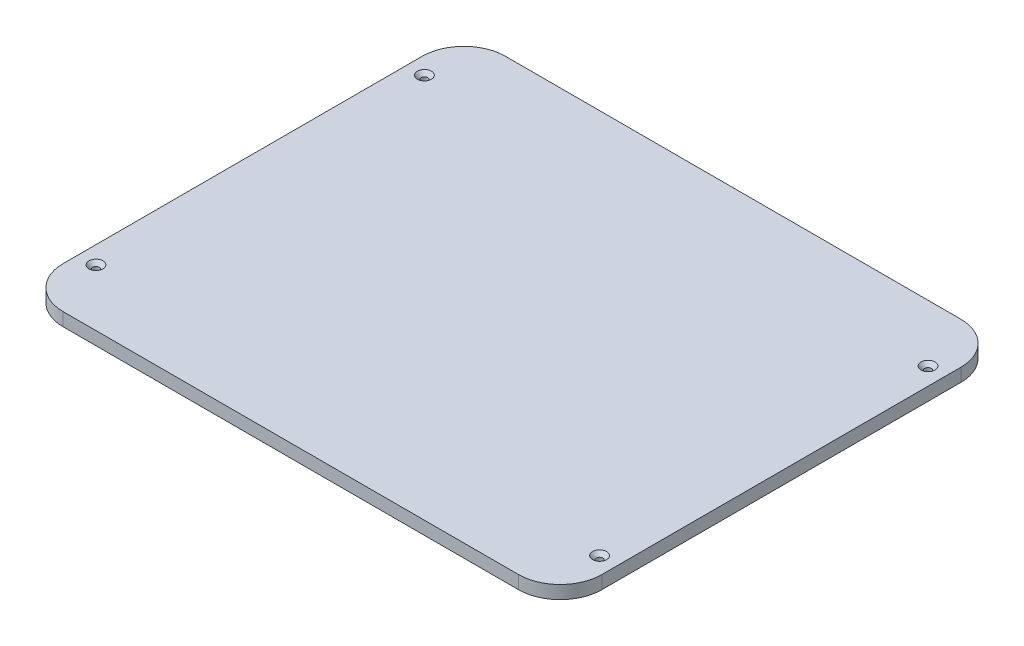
SolidWorks part; units mm, degrees
ref_plane "Alzado" through (0, 0, 0) normal (0, 0, 1) x (1, 0, 0)
ref_plane "Planta" through (0, 0, 0) normal (0, 1, 0) x (1, 0, 0)
ref_plane "Vista lateral" through (0, 0, 0) normal (1, 0, 0) x (0, 0, -1)
sketch "Croquis1" plane through (0, 0, 0) normal (0, 1, 0) x (1, 0, 0)
  line L1 (-123, -101) -> (123, -101)
  line L2 (-123, -101) -> (-123, 101)
  line L3 (-123, 101) -> (123, 101)
  line L4 (123, -101) -> (123, 101)
  line L5 (-123, -101) -> (123, 101) construction
  line L6 (-123, 101) -> (123, -101) construction
  point P0 (0, 0)
  dimension "D1" = 246
  dimension "D2" = 202
extrude "Saliente-Extruir1" add sketch "Croquis1" along normal blind 6
fillet "Redondeo1" radius 19 4 edges at (-123, 3, -101) (123, 3, -101) (123, 3, 101) (-123, 3, 101)
sketch "Croquis3" plane through (0, 6, 0) normal (0, 1, 0) x (1, 0, 0)
  line L0 (0, -3.3) -> (0, 3.3) construction
  line L1 (-123, 82) -> (-123, -82) construction
  line L2 (-115, 93) -> (115, 93) construction
  line L3 (-115, 93) -> (-115, -93) construction
  line L4 (-115, -93) -> (115, -93) construction
  line L5 (115, 93) -> (115, -93) construction
  line L6 (104, 101) -> (-104, 101) construction
  line L7 (123, -82) -> (123, 82) construction
  line L8 (-104, -101) -> (104, -101) construction
  line L9 (-100, 93) -> (-100, -93) construction
  line L10 (100, 93) -> (100, -93) construction
  line L11 (-115, -75) -> (115, -75) construction
  line L12 (-115, 75) -> (115, 75) construction
  line L14 (-116.3755, 75) -> (-116.3755, -75) construction
  circle A0 centre (-100, 93) radius 1.5 construction
  circle A1 centre (100, 93) radius 1.5 construction
  circle A2 centre (-100, -93) radius 1.5 construction
  circle A3 centre (100, -93) radius 1.5 construction
  circle A4 centre (-115, 75) radius 1.5
  circle A5 centre (-115, -75) radius 1.5
  circle A6 centre (115, -75) radius 1.5
  circle A7 centre (115, 75) radius 1.5
  point P33 (-116.3755, 0)
  dimension "D1" = 200
  dimension "D3" = 3
  dimension "D8" = 150
  dimension "D2" = 100
  dimension "D4" = 8
  dimension "D5" = 8
  dimension "D6" = 8
  dimension "D7" = 8
extrude "Cortar-Extruir1" cut sketch "Croquis3" against normal through all
chamfer "Chaflán1" distance 1.7 angle 45 4 edges at (-115, 6, 76.5) (115, 6, 76.5) (115, 6, -73.5) (-115, 6, -73.5)
